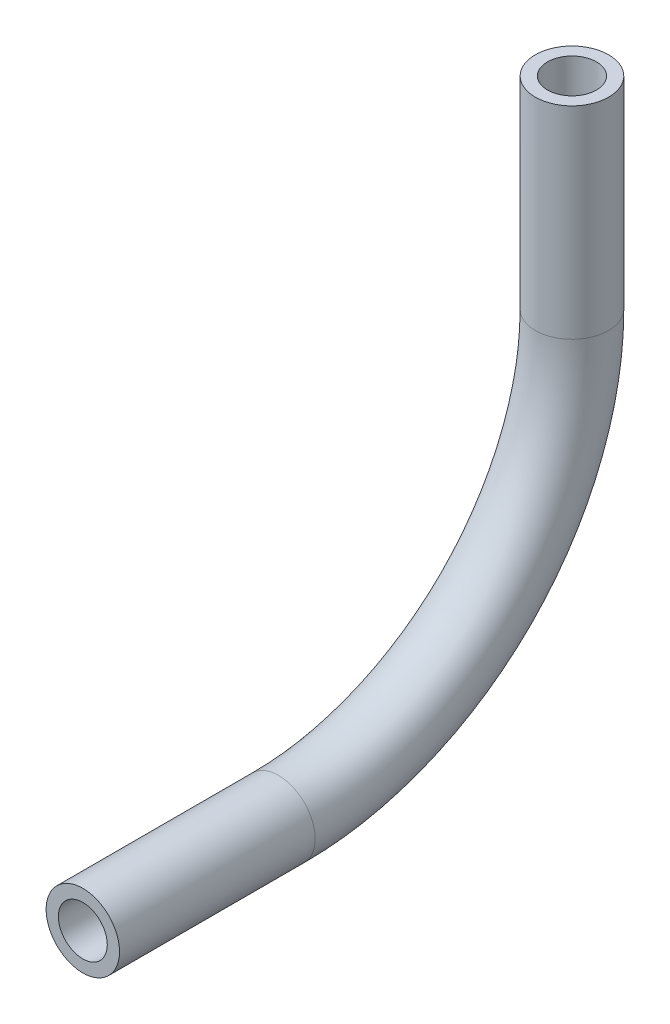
SolidWorks part; units mm, degrees
ref_plane "Front Plane" through (0, 0, 0) normal (0, 0, 1) x (1, 0, 0)
ref_plane "Top Plane" through (0, 0, 0) normal (0, 1, 0) x (1, 0, 0)
ref_plane "Right Plane" through (0, 0, 0) normal (1, 0, 0) x (0, 0, -1)
sketch "Sketch1" plane through (0, 0, 0) normal (0, 0, 1) x (1, 0, 0)
  circle A0 centre (0, 0) radius 9.525
  circle A1 centre (0, 0) radius 6.35
  dimension "D1" = 3.175
  dimension "D2" = 19.05
sketch "Sketch2" plane through (0, 0, 0) normal (1, 0, 0) x (0, 0, -1)
  line L0 (0, 0) -> (50.8, 0)
  line L1 (127, 76.2) -> (127, 128.6802)
  line L2 (194.8793, 179.4802) -> (-741.0419, 179.4802) construction
  arc A0 (50.8, 0) -> (127, 76.2) centre (50.8, 76.2) ccw
  point P6 (127, 0)
  dimension "D3" = 76.2
  dimension "D1" = 50.8
  dimension "D2" = 50.8
sweep "Sweep1" add profiles "Sketch1" path "Sketch2"
